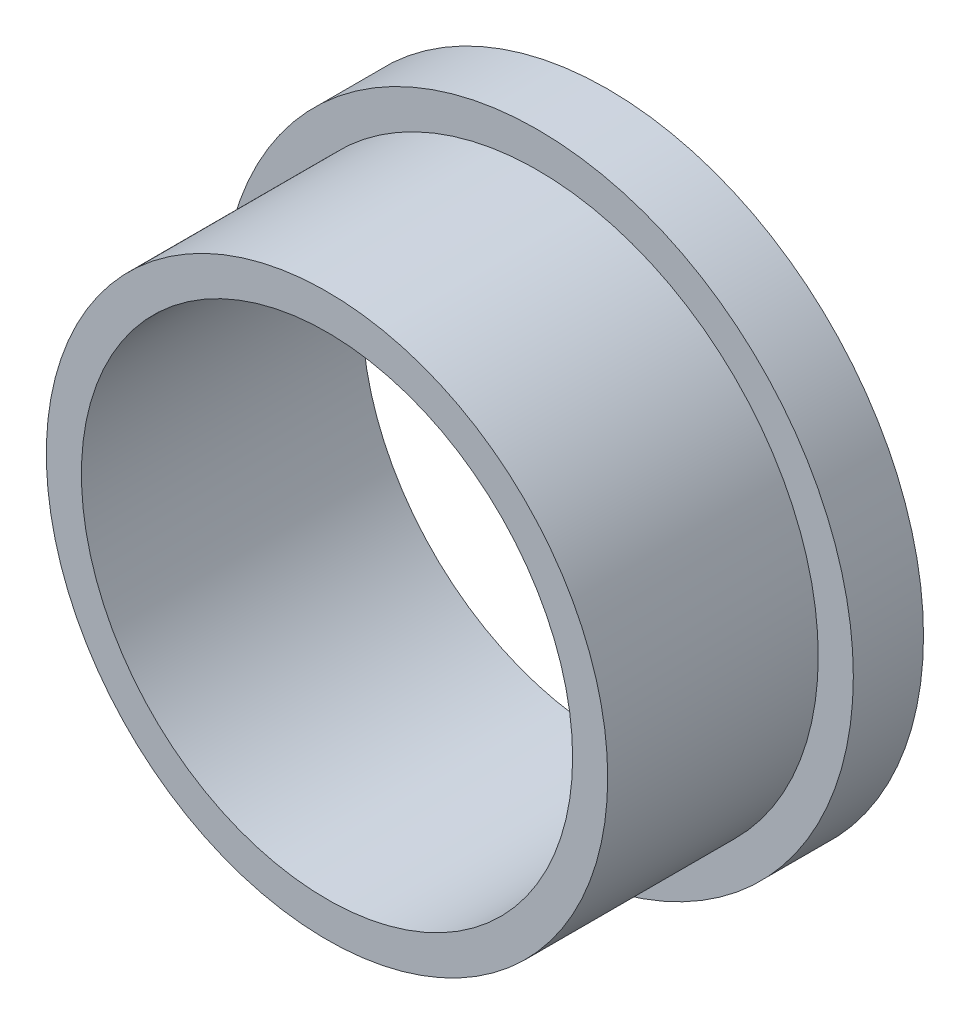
SolidWorks part; units mm, degrees
ref_plane "Face" through (0, 0, 0) normal (0, 0, 1) x (1, 0, 0)
ref_plane "Dessus" through (0, 0, 0) normal (0, 1, 0) x (1, 0, 0)
ref_plane "Droite" through (0, 0, 0) normal (1, 0, 0) x (0, 0, -1)
sketch "Esquisse1" plane through (0, 0, 0) normal (0, 0, 1) x (1, 0, 0)
  circle A0 centre (0, 0) radius 4.5
  dimension "D1" = 9
extrude "Extrusion1" add sketch "Esquisse1" along normal blind 1
sketch "Esquisse2" plane through (0, 0, 1) normal (0, 0, 1) x (1, 0, 0)
  circle A0 centre (0, 0) radius 4
  dimension "D1" = 8
extrude "Extrusion2" add sketch "Esquisse2" along normal blind 3
sketch "Esquisse3" plane through (0, 0, 4) normal (0, 0, 1) x (1, 0, 0)
  circle A0 centre (0, 0) radius 3.5
  dimension "D1" = 7
extrude "Enlèv. mat.-Extru.1" cut sketch "Esquisse3" against normal through all
